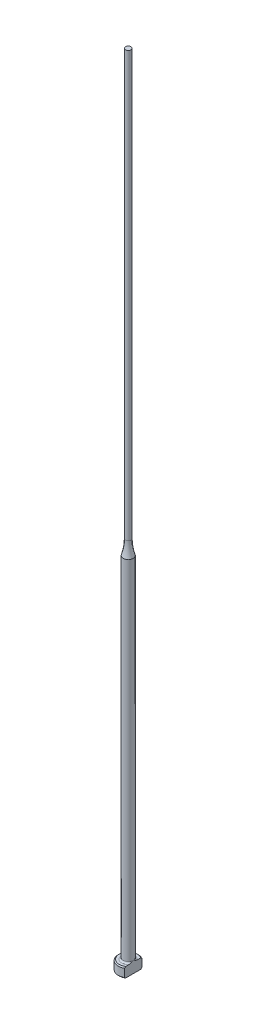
SolidWorks part; units mm, degrees
ref_plane "Front Plane" through (0, 0, 0) normal (0, 0, 1) x (1, 0, 0)
ref_plane "Top Plane" through (0, 0, 0) normal (0, 1, 0) x (1, 0, 0)
ref_plane "Right Plane" through (0, 0, 0) normal (1, 0, 0) x (0, 0, -1)
sketch "Sketch1" plane through (0, 0, 0) normal (0, 0, 1) x (1, 0, 0)
  line L0 (0, 259.9588) -> (0, -15.1925) construction
  line L1 (0, 0) -> (-2, 0)
  line L2 (-2, 0) -> (-2, 2)
  line L3 (-2, 2) -> (-1, 2)
  line L4 (-0.55, 75) -> (-0.55, 160)
  line L5 (-0.55, 160) -> (0, 160)
  line L6 (0, 160) -> (0, 0)
  line L7 (-1, 2) -> (-1, 72.0339)
  arc A0 (-1, 72.0339) -> (-0.55, 75) centre (-10.55, 75) ccw
  point P13 (-1, 0)
  dimension "D1" = 10
  dimension "L" = 160
  dimension "H" = 4
  dimension "T" = 2
  dimension "D" = 1.1
  dimension "B" = 2
  dimension "S" = 75
revolve "Revolve1" add sketch "Sketch1" angle 360 about L0
chamfer "Chamfer1" distance 0.2 angle 45 2 edges at (0, 2, 2) (0, 0, 2)
fillet "Fillet1" radius 0.3 1 edges at (0, 2, 1)
sketch "Sketch2" plane through (0, 0, 0) normal (0, 1, 0) x (1, 0, 0)
  line L0 (1, 1.7321) -> (1, -1.7321)
  circle A0 centre (0, 0) radius 2 construction
  arc A1 (1, -1.7321) -> (1, 1.7321) centre (0, 0) ccw
  circle A2 centre (0, 0) radius 1 construction
extrude "KEY" cut sketch "Sketch2" along normal through all
